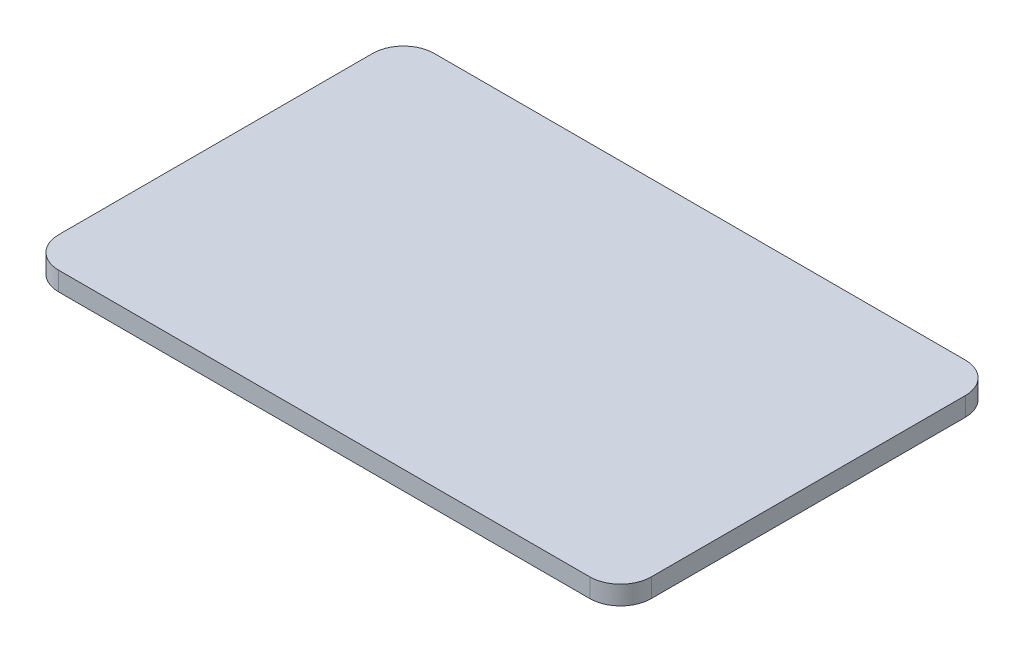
SolidWorks part; units mm, degrees
ref_plane "Front Plane" through (0, 0, 0) normal (0, 0, 1) x (1, 0, 0)
ref_plane "Top Plane" through (0, 0, 0) normal (0, 1, 0) x (1, 0, 0)
ref_plane "Right Plane" through (0, 0, 0) normal (1, 0, 0) x (0, 0, -1)
sketch "Sketch1" plane through (0, 0, 0) normal (0, 1, 0) x (1, 0, 0)
  line L1 (3, 0) -> (54.84, 0)
  line L2 (0, 3) -> (0, 33.65)
  line L3 (3, 36.65) -> (54.84, 36.65)
  line L4 (57.84, 3) -> (57.84, 33.65)
  arc A0 (3, 0) -> (0, 3) centre (3, 3) cw
  arc A1 (54.84, 0) -> (57.84, 3) centre (54.84, 3) ccw
  arc A2 (54.84, 36.65) -> (57.84, 33.65) centre (54.84, 33.65) cw
  arc A3 (0, 33.65) -> (3, 36.65) centre (3, 33.65) cw
  point P5 (0, 0)
  point P8 (0, 0)
  point P11 (57.84, 0)
  point P16 (0, 36.65)
  dimension "D3" = 3
  dimension "D1" = 57.84
  dimension "D2" = 36.65
extrude "Boss-Extrude1" add sketch "Sketch1" along normal blind 1.84
